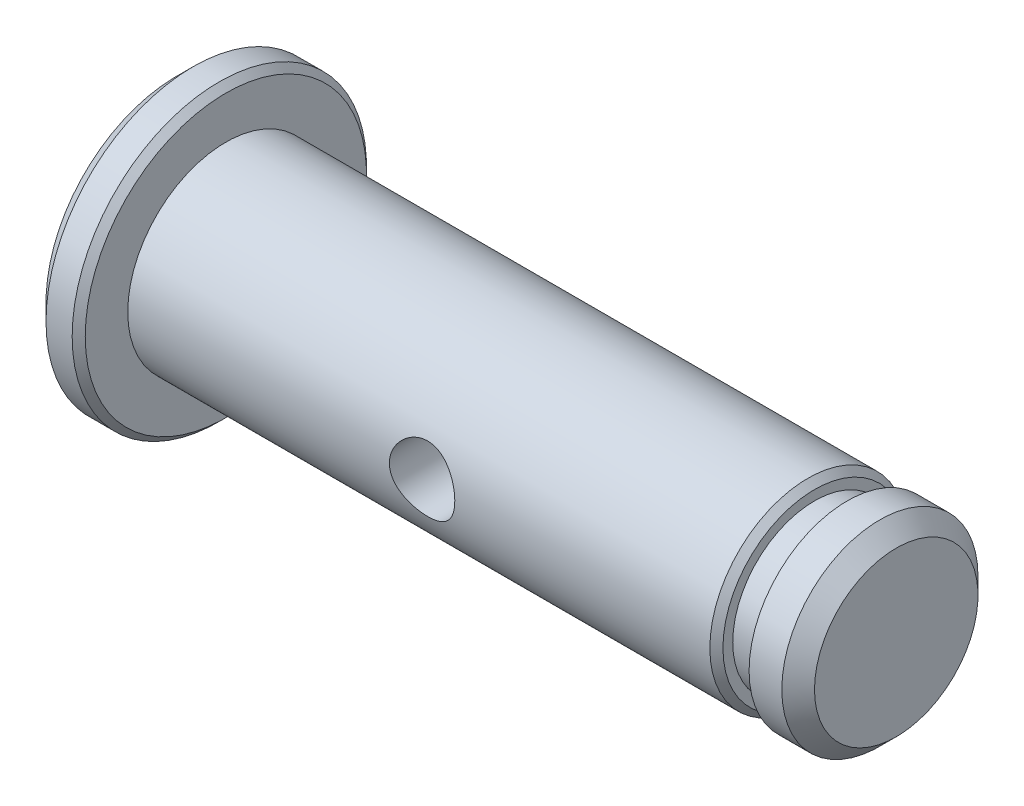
SolidWorks part; units mm, degrees
ref_plane "前视" through (0, 0, 0) normal (0, 0, 1) x (1, 0, 0)
ref_plane "上视" through (0, 0, 0) normal (0, 1, 0) x (1, 0, 0)
ref_plane "右视" through (0, 0, 0) normal (1, 0, 0) x (0, 0, -1)
sketch "草图1" plane through (0, 0, 0) normal (0, 0, 1) x (1, 0, 0)
  line L0 (0, 0) -> (77.1831, 0) construction
  line L1 (0, 0) -> (0, 4.5)
  line L2 (0, 4.5) -> (1.5, 4.5)
  line L3 (1.5, 4.5) -> (1.5, 3)
  line L4 (1.5, 3) -> (19.5, 3)
  line L5 (19.5, 3) -> (19.5, 2.5)
  line L6 (19.5, 2.5) -> (20.5, 2.5)
  line L7 (20.5, 2.5) -> (20.5, 3)
  line L8 (20.5, 3) -> (22, 3)
  line L9 (22, 3) -> (22, 0)
  line L10 (22, 0) -> (0, 0)
  dimension "D1" = 1.5
  dimension "D2" = 1
  dimension "D3" = 0.5
  dimension "D4" = 6
  dimension "D5" = 1.5
  dimension "D6" = 9
  dimension "D7" = 18
revolve "旋转1" add sketch "草图1" angle 360 about L0
chamfer "倒角1" distance 0.5 angle 45 2 edges at (22, 0, 3) (0, 0, 4.5)
sketch "草图2" plane through (0, 0, 0) normal (0, 0, 1) x (1, 0, 0)
  line L0 (0, 0) -> (26.5863, 0) construction
  line L1 (1.5, -4.5) -> (1.5, 4.5) construction
  circle A0 centre (10.5, 0) radius 1
  dimension "D1" = 2
  dimension "D2" = 9
extrude "切除-拉伸1" cut sketch "草图2" against normal mid plane 30
chamfer "倒角2" distance 0.2 angle 45 2 edges at (19.5, 0, 3) (1.5, 0, 4.5)
